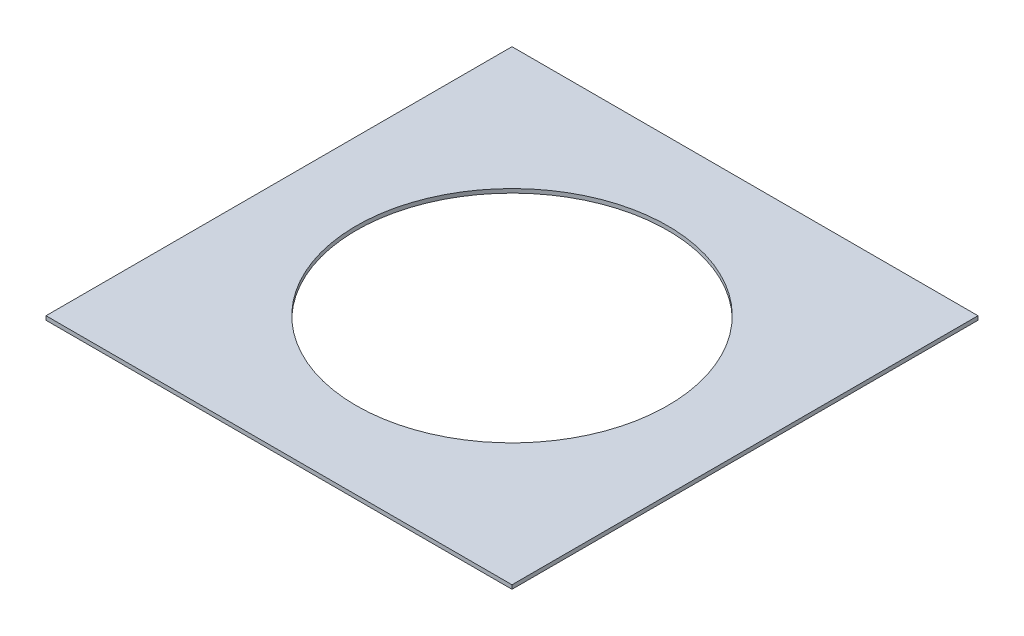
SolidWorks part; units mm, degrees
ref_plane "Front" through (0, 0, 0) normal (0, 0, 1) x (1, 0, 0)
ref_plane "Top" through (0, 0, 0) normal (0, 1, 0) x (1, 0, 0)
ref_plane "Right" through (0, 0, 0) normal (1, 0, 0) x (0, 0, -1)
sketch "Sketch1" plane through (0, 0, 0) normal (0, 1, 0) x (1, 0, 0)
  line L1 (-93.472, -93.472) -> (93.472, -93.472)
  line L2 (-93.472, -93.472) -> (-93.472, 93.472)
  line L3 (-93.472, 93.472) -> (93.472, 93.472)
  line L4 (93.472, -93.472) -> (93.472, 93.472)
  line L5 (-93.472, -93.472) -> (93.472, 93.472) construction
  line L6 (-93.472, 93.472) -> (93.472, -93.472) construction
  circle A0 centre (0, 0) radius 62.484
  dimension "D1" = 124.968
  dimension "D2" = 186.944
extrude "Boss-Extrude1" add sketch "Sketch1" along normal blind 1.5875
